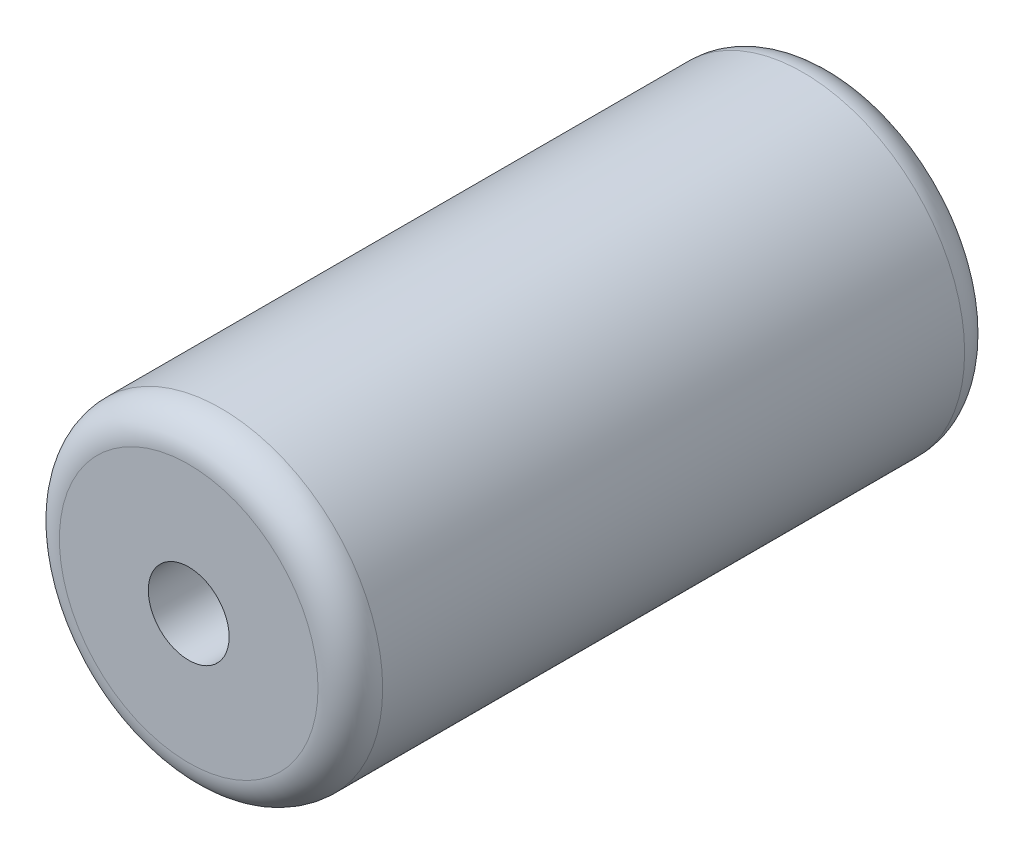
SolidWorks part; units mm, degrees
ref_plane "Front Plane" through (0, 0, 0) normal (0, 0, 1) x (1, 0, 0)
ref_plane "Top Plane" through (0, 0, 0) normal (0, 1, 0) x (1, 0, 0)
ref_plane "Right Plane" through (0, 0, 0) normal (1, 0, 0) x (0, 0, -1)
sketch "Sketch1" plane through (0, 0, 0) normal (0, 0, 1) x (1, 0, 0)
  circle A0 centre (0, 0) radius 12.7
  circle A1 centre (0, 0) radius 3.175
  dimension "D1" = 25.4
  dimension "D2" = 6.35
extrude "Boss-Extrude1" add sketch "Sketch1" along normal blind 50.8
fillet "Fillet1" radius 2.54 2 edges at (12.7, 0, 50.8) (12.7, 0, 0)
